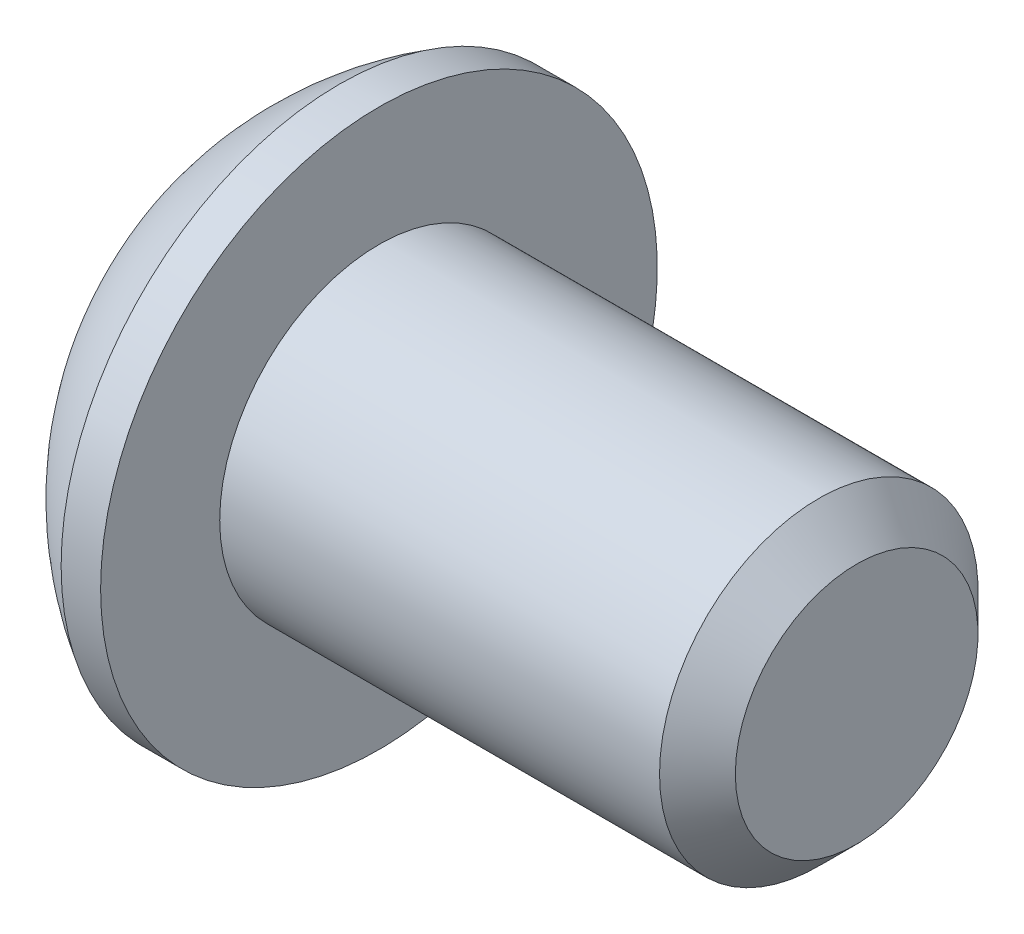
SolidWorks part; units mm, degrees
ref_plane "Plane1" through (0, 0, 0) normal (0, 0, 1) x (1, 0, 0)
ref_plane "Plane2" through (0, 0, 0) normal (0, 1, 0) x (1, 0, 0)
ref_plane "Plane3" through (0, 0, 0) normal (1, 0, 0) x (0, 0, -1)
other "Configuration Table"
sketch "BodySke" plane through (0, 0, 0) normal (0, 0, 1) x (1, 0, 0)
  line L0 (12.8778, 0) -> (12.8778, 2.4193)
  line L1 (12.1222, 3.175) -> (3.3528, 3.175)
  line L2 (3.3528, 3.175) -> (3.3528, 5.5499)
  line L3 (3.3528, 5.5499) -> (2.5654, 5.5499)
  line L4 (0, 0) -> (101.6, 0) construction
  line L5 (3.3528, -5.5499) -> (2.5654, -5.5499) construction
  line L6 (55.6768, -3.175) -> (3.3528, -3.175) construction
  line L7 (12.8778, 0) -> (0, 0)
  line L8 (0, 2.775) -> (0, -2.775) construction
  line L9 (0, 0) -> (0, 2.775)
  line L10 (12.8778, 2.4193) -> (12.1222, 3.175)
  line L11 (12.8778, -2.4193) -> (12.1222, -3.175) construction
  line L12 (4.6228, 9.525) -> (4.6228, -3.175) construction
  line L13 (3.3528, 9.525) -> (3.3528, -3.175) construction
  arc A1 (0, 2.775) -> (2.5654, 5.5499) centre (5.7851, 0) cw
revolve "BaseBody" add sketch "BodySke" angle 360 about L4
sketch "Sketch2" plane through (0, 0, 0) normal (0, 0, 1) x (1, 0, 0)
  line L0 (0, 1.9812) -> (2.2098, 1.9812)
  line L1 (2.2098, 1.9812) -> (3.3536, 0)
  line L3 (3.3536, 0) -> (0, 0)
  line L4 (0, 0) -> (0, 1.9812)
  line L5 (0, -1.9812) -> (2.2098, -1.9812) construction
  line L6 (0, 0) -> (47.625, 0) construction
  dimension "D2" = 60
  dimension "PreBroach_depth" = 2.2098
  dimension "PreBroach_dia" = 3.9624
revolve "PreBroach" cut sketch "Sketch2" angle 360 about L6
sketch "Sketch3" plane through (0, 0, 0) normal (1, 0, 0) x (0, 0, -1)
  line L0 (-1.9812, -1.1438) -> (-1.9812, 1.1438)
  line L1 (-1.9812, 1.1438) -> (0, 2.2877)
  line L2 (0, 2.2877) -> (1.9812, 1.1438)
  line L3 (1.9812, 1.1438) -> (1.9812, -1.1438)
  line L4 (1.9812, -1.1438) -> (0, -2.2877)
  line L5 (0, -2.2877) -> (-1.9812, -1.1438)
extrude "Hex" cut sketch "Sketch3" along normal blind 2.2098
sketch "Sketch4" plane through (0, 9.525, 0) normal (1, 0, 0) x (0, 0, -1)
  line L0 (0, -9.525) -> (2.3876, -9.525)
  line L1 (0, -9.525) -> (6.1484, -5.9752) construction
  line L2 (0, -9.525) -> (1.1938, -7.4573)
  line L3 (1.9883, -8.949) -> (2.2704, -8.7861)
  line L4 (1.493, -8.0911) -> (1.7751, -7.9282)
  arc A0 (1.9883, -8.949) -> (1.493, -8.0911) centre (0, -9.525) ccw
  arc A1 (2.3876, -9.525) -> (2.2704, -8.7861) centre (0, -9.525) ccw
  arc A2 (1.1938, -7.4573) -> (1.7751, -7.9282) centre (0, -9.525) cw
extrude "Spline" [suppressed] cut sketch "Sketch4" along normal blind 2.2098
pattern_circular "CirPattern1" [suppressed] count 6 every 60 about axis through (0, 0, 0) along (1, 0, 0)
sketch "ThdSchSke" plane through (0, 0, 0) normal (0, 0, 1) x (1, 0, 0)
  line L0 (4.6228, -2.4193) -> (4.0937, -3.175)
  line L1 (4.6228, -2.4193) -> (5.1519, -3.175)
  line L2 (5.1519, -3.175) -> (5.1519, -3.9688)
  line L3 (-3.175, 0) -> (5.1513, 0) construction
  line L5 (5.1519, -3.9688) -> (4.0937, -3.9688)
  line L6 (4.0937, -3.9688) -> (4.0937, -3.175)
revolve "ThreadSchematic" [suppressed] cut sketch "ThdSchSke" angle 360 about L3
pattern_linear "ThdSchPat" [suppressed]
equation "\"D1@BodySke\" = \"Head_dia@BodySke\" * .5"
equation "\"Thread_minor@ThreadCosmetic\" = \"Minor_dia@BodySke\""
equation "\"D1@Sketch3\" = \"Hex_size@Sketch3\" / 2"
equation "\"D2@Sketch3\" = \"D1@Sketch3\""
equation "\"D3@Sketch3\" = \"Hex_size@Sketch3\""
equation "\"D3@Sketch4\" = \"Spline_p_dim@Sketch4\" / 2"
equation "\"D1@Sketch4\" = \"D2@Sketch4\" / 2"
equation "\"Thread_length@ThreadCosmetic\" = ((sgn( (\"Length@BodySke\" - \"Advance@BodySke\" ) - \"Thread_nom@BodySke\" )-1)*( (\"Length@BodySke\" - \"Advance@BodySke\" ) - \"Thread_nom@BodySke\" ))/-2+ \"Thread_nom@BodySke\""
equation "\"Thread_minor@ThdSchSke\" = \"Minor_dia@BodySke\""
equation "\"Diameter@ThdSchSke\" = \"Diameter@BodySke\""
equation "\"Overcut@ThdSchSke\" = \"Diameter@BodySke\" * 1.25"
equation "\"Start@ThdSchSke\" = \"Head_ht@BodySke\" + \"Length@BodySke\" - \"Thread_length@ThreadCosmetic\"  '---Non-countersunk---"
equation "\"Num_threads@ThdSchPat\" = int( \"Thread_length@ThreadCosmetic\" / \"Advance@BodySke\" + 0.999 )  + 1"
equation "\"Advance@ThdSchPat\" = \"Thread_length@ThreadCosmetic\" /  (\"Num_threads@ThdSchPat\" - 1) 'relax it"
equation "\"Num_threads@ThdSchPat\" = \"Num_threads@ThdSchPat\" - sgn( \"Num_threads@ThdSchPat\" - 1) '---chamfered tips only---"
